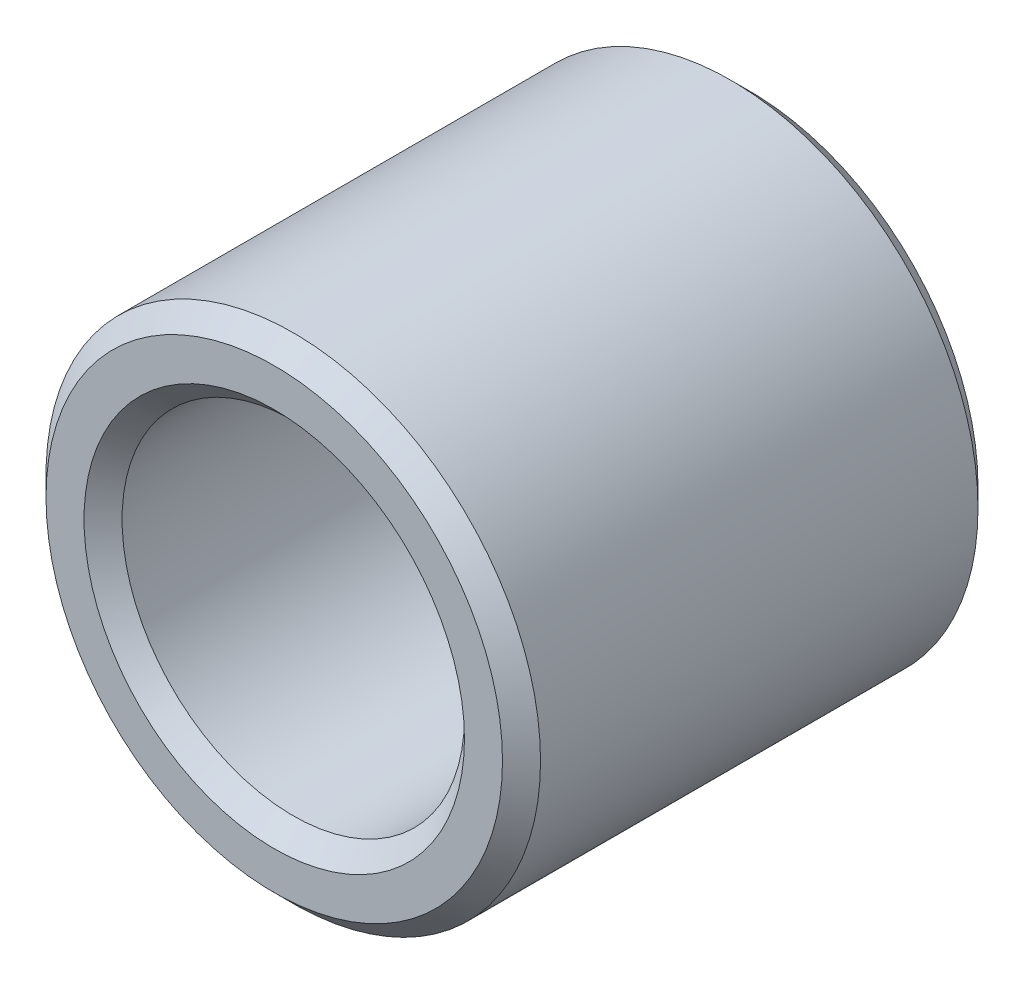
SolidWorks part; units mm, degrees
ref_plane "FACE" through (0, 0, 0) normal (0, 0, 1) x (1, 0, 0)
ref_plane "DESSUS" through (0, 0, 0) normal (0, 1, 0) x (1, 0, 0)
ref_plane "GAUCHE" through (0, 0, 0) normal (1, 0, 0) x (0, 0, -1)
sketch "Esquisse1" plane through (0, 0, 0) normal (0, 0, 1) x (1, 0, 0)
  circle A0 centre (0, 0) radius 4.5
  circle A1 centre (0, 0) radius 6.5
  dimension "D1" = 13
  dimension "D2" = 9
extrude "Base-Extrusion" add sketch "Esquisse1" along normal blind 12.5
chamfer "Chanfrein1" distance 0.5 angle 45 4 edges at (6.5, 0, 0) (6.5, 0, 12.5) (4.5, 0, 0) (4.5, 0, 12.5)
